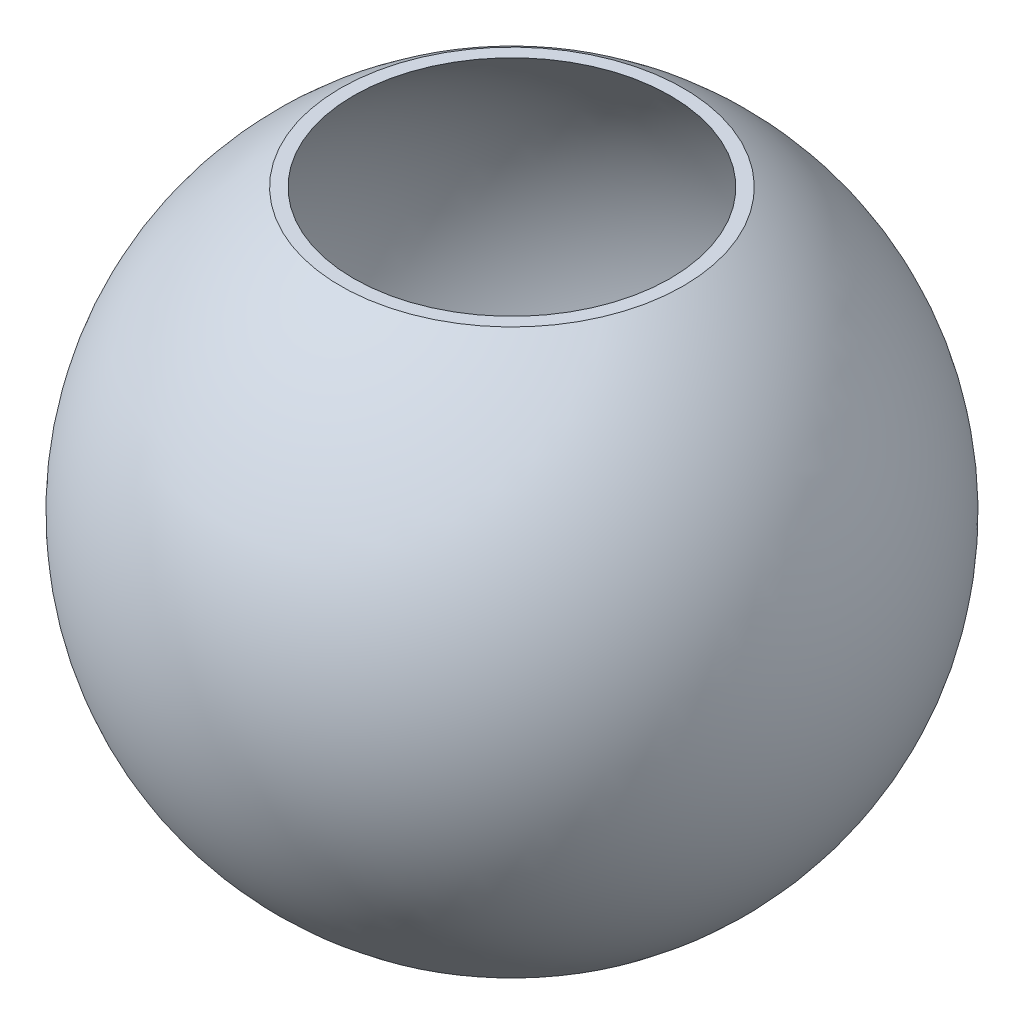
SolidWorks part; units mm, degrees
ref_plane "Płaszczyzna przednia" through (0, 0, 0) normal (0, 0, 1) x (1, 0, 0)
ref_plane "Płaszczyzna górna" through (0, 0, 0) normal (0, 1, 0) x (1, 0, 0)
ref_plane "Płaszczyzna prawa" through (0, 0, 0) normal (1, 0, 0) x (0, 0, -1)
sketch "Szkic1" plane through (0, 0, 0) normal (0, 0, 1) x (1, 0, 0)
  line L1 (0, -50) -> (0, -49)
  line L2 (26, 42.7083) -> (0, 42.7083) construction
  line L3 (0, 42.7083) -> (0, 0) construction
  line L4 (24.0208, 42.7083) -> (26, 42.7083)
  arc A0 (0, -50) -> (26, 42.7083) centre (0, 0) ccw
  arc A1 (0, -49) -> (24.0208, 42.7083) centre (0, 0) ccw
  dimension "D1" = 1
  dimension "D2" = 50
revolve "Obrót1" add sketch "Szkic1" angle 360 about L3
sketch "Szkic2" plane through (0, 0, 0) normal (0, 1, 0) x (1, 0, 0)
  circle A0 centre (0, 0) radius 13
ref_plane "Płaszczyzna1" through (0, 110, 0) normal (0, 1, 0) x (1, 0, 0)
